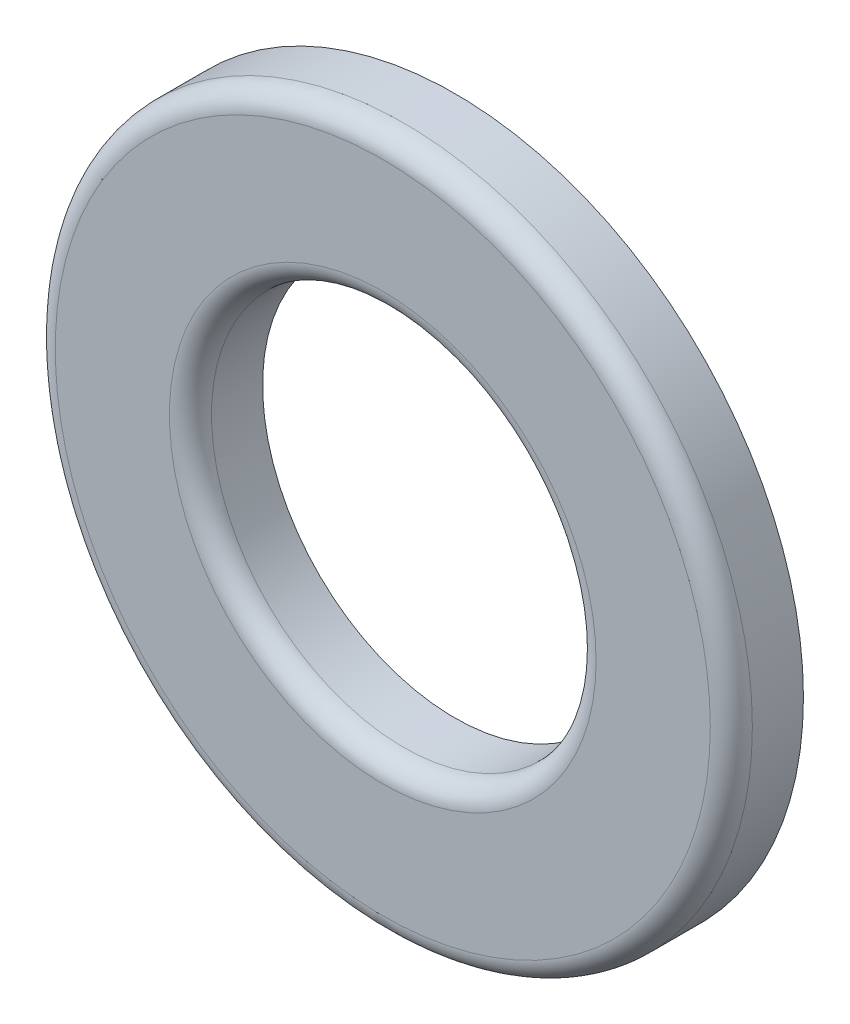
SolidWorks part; units mm, degrees
ref_plane "Plan1" through (0, 0, 0) normal (0, 0, 1) x (1, 0, 0)
ref_plane "Plan2" through (0, 0, 0) normal (0, 1, 0) x (1, 0, 0)
ref_plane "Plan3" through (0, 0, 0) normal (1, 0, 0) x (0, 0, -1)
sketch "Esquisse1" plane through (0, 0, 0) normal (0, 0, 1) x (1, 0, 0)
  circle A0 centre (0, 0) radius 3.2
  circle A1 centre (0, 0) radius 5.8
  dimension "D1" = 11.6
  dimension "D2" = 6.4
extrude "Base-Extrusion" add sketch "Esquisse1" along normal blind 1.2
fillet "Congé1" radius 0.35
